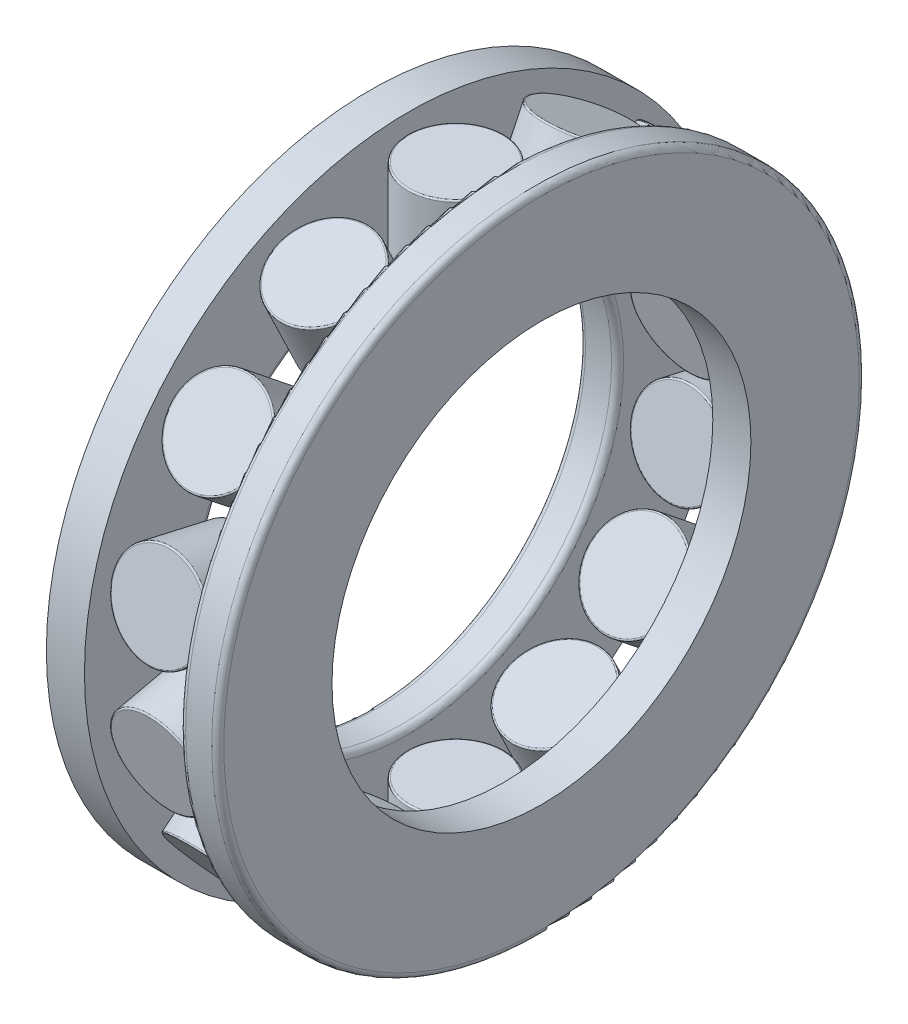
SolidWorks part; units mm, degrees
ref_plane "Plane1" through (0, 0, 0) normal (0, 0, 1) x (1, 0, 0)
ref_plane "Plane2" through (0, 0, 0) normal (0, 1, 0) x (1, 0, 0)
ref_plane "Plane3" through (0, 0, 0) normal (1, 0, 0) x (0, 0, -1)
other "Configuration Table"
sketch "Clipboard" plane through (0, 0, 0) normal (0, 0, 1) x (1, 0, 0)
  line L0 (-10, 0) -> (10, 0) construction
  line L1 (0, 0) -> (21.6965, -5.4095)
  line L2 (0, 0) -> (27.3662, 35.0271)
  line L3 (0, 0) -> (13.7666, -17.6205)
  line L4 (0, 0) -> (-22.3471, -0.7804)
sketch "InnRacSke" plane through (0, 0, 0) normal (0, 0, 1) x (1, 0, 0)
  line L1 (-7.9375, 34.925) -> (-14.2875, 34.925)
  line L2 (-14.2875, 34.925) -> (-14.2875, 53.975)
  line L3 (-14.2875, 53.975) -> (-7.9375, 53.975)
  line L4 (-7.9375, 53.975) -> (-7.9375, 34.925)
  line L5 (-34.925, 0) -> (34.925, 0) construction
  line L6 (0, 0) -> (0, 25.4) construction
revolve "Race" add sketch "InnRacSke" angle 360 about L5
ref_axis "Axis1" through (-50, 0, 0) along (1, 0, 0)
sketch "RolDetSke" plane through (0, 0, 0) normal (0, 0, 1) x (1, 0, 0)
  line L0 (0, 33.02) -> (0, 55.88) construction
  line L3 (0, 50.8) -> (7.7232, 50.8)
  line L4 (0, 50.8) -> (0, 38.1)
  line L5 (0, 38.1) -> (7.7232, 38.1)
  line L6 (7.9772, 50.546) -> (7.9772, 38.354)
  arc A0 (7.9772, 38.354) -> (7.7232, 38.1) centre (7.7232, 38.354) cw
  arc A1 (7.7232, 50.8) -> (7.9772, 50.546) centre (7.7232, 50.546) cw
revolve "RollerDetailed" add sketch "RolDetSke" angle 360 about L0
sketch "RolSimSke" plane through (0, 0, 0) normal (0, 0, 1) x (1, 0, 0)
  line L1 (-17.78, 0) -> (12.7, 0) construction
  line L3 (-7.7232, 50.8) -> (7.7232, 50.8)
  line L4 (-7.9772, 50.546) -> (-7.9772, 38.354)
  line L5 (-7.7232, 38.1) -> (7.7232, 38.1)
  line L6 (7.9772, 50.546) -> (7.9772, 38.354)
  arc A0 (-7.9772, 38.354) -> (-7.7232, 38.1) centre (-7.7232, 38.354) ccw
  arc A1 (-7.7232, 50.8) -> (-7.9772, 50.546) centre (-7.7232, 50.546) ccw
  arc A2 (7.9772, 50.546) -> (7.7232, 50.8) centre (7.7232, 50.546) ccw
  arc A3 (7.7232, 38.1) -> (7.9772, 38.354) centre (7.7232, 38.354) ccw
revolve "RollersSimplified" [suppressed] add sketch "RolSimSke" angle 360 about L1
mirror "Mirror1" about plane through (0, 0, 0) normal (1, 0, 0) of "Race"
fillet "Fillet" radius 1 4 edges at (7.9375, 0, -53.975) (14.2875, 0, -53.975) (-7.9375, 0, -34.925) (-14.2875, 0, -34.925)
pattern_circular "RollersDetailed" count 14 every 25.714 about axis through (-50, 0, 0) along (1, 0, 0) of "RollerDetailed"
sketch "CagSpiSke" plane through (0, 0, 0) normal (0, 0, 1) x (1, 0, 0)
  line L0 (2.3932, 35.6235) -> (2.3932, 52.8955)
  line L1 (2.3932, 52.8955) -> (-2.3932, 52.8955)
  line L2 (-2.3932, 35.6235) -> (-2.3932, 52.8955)
  line L3 (-2.3932, 35.6235) -> (2.3932, 35.6235)
  line L4 (-34.925, 0) -> (34.925, 0) construction
  line L5 (0, 0) -> (0, 63.1161) construction
revolve "CageSpine" [suppressed] add sketch "CagSpiSke" angle 360 about L4
equation "\"BallCLRad@Clipboard\" =  ( \"OD@InnRacSke\" + \"ID@InnRacSke\" )  / 4"
equation "\"offset@RolDetSke\" = \"BallCLRad@Clipboard\" - \"Cyl_Len@RolDetSke\" / 2"
equation "\"Cyl_Len@RolSimSke\" = \"Cyl_Len@RolDetSke\""
equation "\"offset@RolSimSke\" = \"BallCLRad@Clipboard\" - \"Cyl_Len@RolSimSke\" / 2"
equation "\"Roller_diameter@RolDetSke\" = \"gap@InnRacSke\" * 1.005"
equation "\"Roller_diameter@RolSimSke\" = \"gap@InnRacSke\" * 1.005"
equation "\"Max_count@Clipboard\" = int( 3.14159265 / atn(( \"Roller_diameter@RolDetSke\" / 2) / sqr( \"offset@RolDetSke\"  *  \"offset@RolDetSke\" - ( \"Roller_diameter@RolDetSke\" / 2) *  ( \"Roller_diameter@RolDetSke\" "
equation "\"Max_count@Clipboard\" = ((sgn( \"Max_count@Clipboard\" - \"Count@Clipboard\" )-1)*( \"Max_count@Clipboard\" - \"Count@Clipboard\" ))/-2+ \"Count@Clipboard\""
equation "\"Count@RollersDetailed\" = int( \"Show_count@Clipboard\" ) "
equation "\"Count@RollersDetailed\" = ((sgn( \"Count@RollersDetailed\" - \"Max_count@Clipboard\" )-1)*( \"Count@RollersDetailed\" - \"Max_count@Clipboard\" ))/-2+ \"Max_count@Clipboard\""
equation "\"Count@RollersDetailed\" = ((sgn( \"Count@RollersDetailed\" - \"Min_count@Clipboard\" )+1)*( \"Count@RollersDetailed\" - \"Min_count@Clipboard\"))/2 +\"Min_count@Clipboard\""
equation "\"Angle@RollersDetailed\" = 360.0 / \"Max_count@Clipboard\""
equation "\"Angle@CageSpine\" =  \"Angle@RollersDetailed\" * ( \"Count@RollersDetailed\" -1 + int( \"Count@RollersDetailed\" / \"Max_count@Clipboard\" ) )  + 0.001 -  int( \"Count@RollersDetailed\" / \"Max_count@Clipboard\" "
equation "\"Angle@CageSpine\" =  \"Angle@CageSpine\" * int( \"Min_count@Clipboard\" / 2) + int(1 / \"Min_count@Clipboard\")  * 0.001"
equation "\"Thickness@CagSpiSke\" =  \"Roller_diameter@RolDetSke\" * 0.3"
equation "\"OD@CagSpiSke\" = \"OD@InnRacSke\" * 0.98"
equation "\"ID@CagSpiSke\" =  \"ID@InnRacSke\" * 1.02"
equation "\"Halfdia@RolSimSke\" = \"Roller_diameter@RolSimSke\" / 2"
